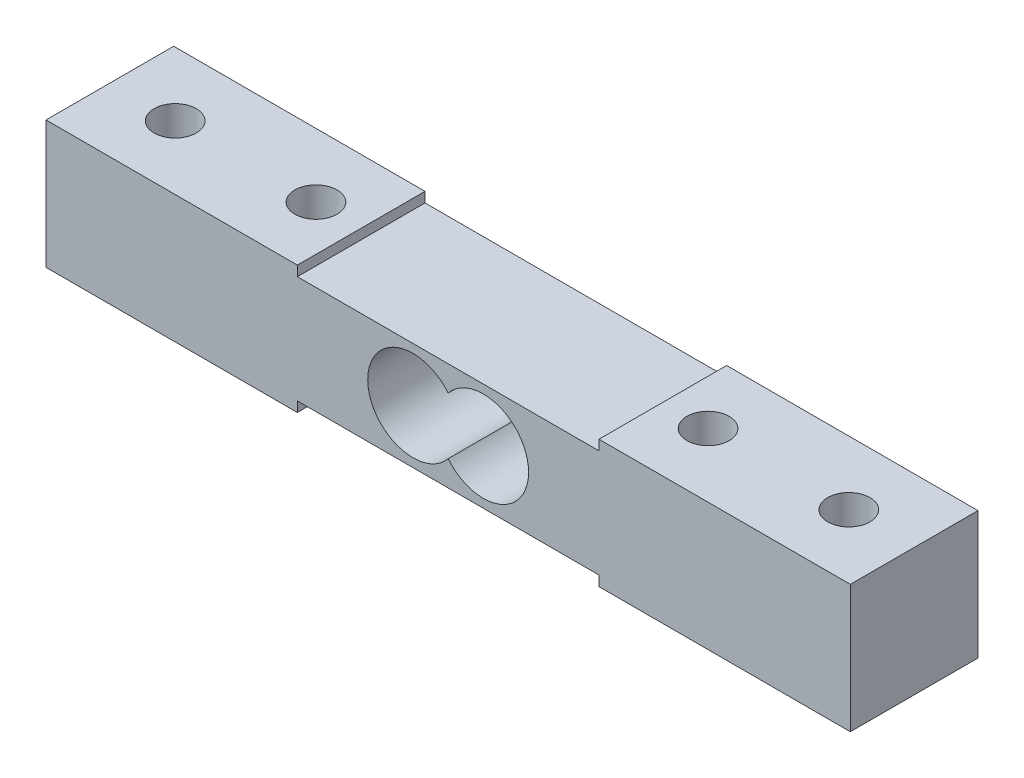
SolidWorks part; units mm, degrees
ref_plane "Front" through (0, 0, 0) normal (0, 0, 1) x (1, 0, 0)
ref_plane "Top" through (0, 0, 0) normal (0, 1, 0) x (1, 0, 0)
ref_plane "Right" through (0, 0, 0) normal (1, 0, 0) x (0, 0, -1)
sketch "Sketch1" plane through (0, 0, 0) normal (0, 1, 0) x (1, 0, 0)
  line L1 (-40, 6.35) -> (40, 6.35)
  line L2 (-40, 6.35) -> (-40, -6.35)
  line L3 (-40, -6.35) -> (40, -6.35)
  line L4 (40, 6.35) -> (40, -6.35)
  line L5 (-40, 6.35) -> (40, -6.35) construction
  line L6 (-40, -6.35) -> (40, 6.35) construction
  point P0 (0, 0)
  dimension "D1" = 80
  dimension "D2" = 12.7
extrude "Boss-Extrude1" add sketch "Sketch1" along normal blind 12.7
hole_wizard "M5x0.8 Tapped Hole1" positions "Sketch2" profile "Sketch3" tap size "M5x0.8" standard "ANSI Metric"
sketch "Sketch2" plane through (0, 12.7, 0) normal (0, 1, 0) x (1, 0, 0)
  line L0 (-40, 6.35) -> (-40, -6.35) construction
  point P0 (-33.5, 0)
  point P2 (-19.5, 0)
  dimension "D1" = 6.5
  dimension "D2" = 14
sketch "Sketch3" plane through (-33.5, 12.7, 0) normal (1, 0, 0) x (0, 0, 1)
  line L0 (0, 0) -> (0, 12.7)
  line L1 (0, 12.7) -> (2.1, 12.7)
  line L2 (2.1, 12.7) -> (2.1, 0)
  line L5 (2.1, 0) -> (0, 0)
  line L11 (0, -6.35) -> (0, 107.95) construction
  dimension "Thru Tap Drill Dia." = 4.2
  dimension "Thru Tap Drill Depth" = 12.7
mirror "Mirror1" about plane through (0, 0, 0) normal (1, 0, 0) of "M5x0.8 Tapped Hole1"
ref_plane "MidPlane" through (0, 6.35, 0) normal (0, 1, 0) x (1, 0, 0)
sketch "Sketch4" plane through (0, 12.7, 0) normal (0, 1, 0) x (1, 0, 0)
  line L0 (-40, -6.35) -> (40, -6.35) construction
  line L1 (-15, 6.35) -> (15, 6.35)
  line L2 (-15, 6.35) -> (-15, -6.35)
  line L3 (-15, -6.35) -> (15, -6.35)
  line L4 (15, 6.35) -> (15, -6.35)
  line L5 (-15, 6.35) -> (15, -6.35) construction
  line L6 (-15, -6.35) -> (15, 6.35) construction
  point P0 (0, 0)
  dimension "D1" = 30
extrude "Cut-Extrude1" cut sketch "Sketch4" against normal blind 1
mirror "Mirror3" about plane through (0, 6.35, 0) normal (0, 1, 0) of "Cut-Extrude1"
sketch "Sketch5" plane through (0, 0, 6.35) normal (0, 0, 1) x (1, 0, 0)
  line L0 (6.985, 6.35) -> (-6.985, 6.35) construction
  line L1 (0, 0) -> (0, 21.0406) construction
  circle A0 centre (3.5, 6.35) radius 4.5
  circle A1 centre (-3.5, 6.35) radius 4.5
  dimension "D1" = 9
  dimension "D2" = 3.5
extrude "Cut-Extrude2" cut sketch "Sketch5" against normal through all contours A0 | A1
